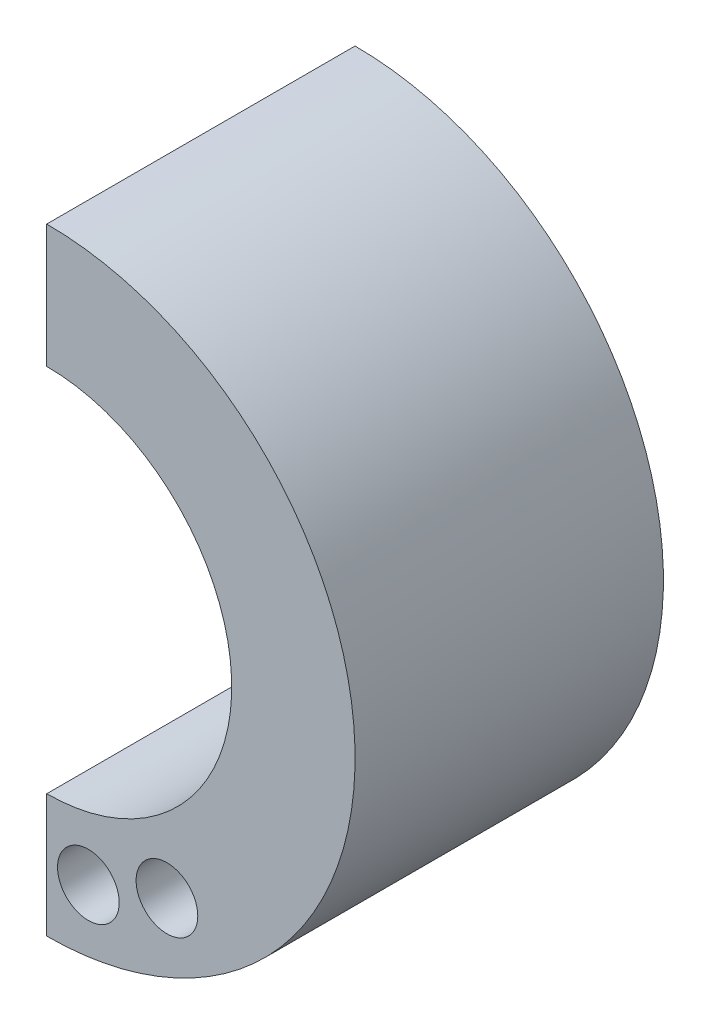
SolidWorks part; units mm, degrees
ref_plane "Ebene vorne" through (0, 0, 0) normal (0, 0, 1) x (1, 0, 0)
ref_plane "Ebene oben" through (0, 0, 0) normal (0, 1, 0) x (1, 0, 0)
ref_plane "Ebene rechts" through (0, 0, 0) normal (1, 0, 0) x (0, 0, -1)
sketch "Skizze1" plane through (0, 0, 0) normal (0, 0, 1) x (1, 0, 0)
  line L0 (0, 50) -> (0, -50)
  arc A0 (0, -50) -> (0, 50) centre (0, 0) ccw
extrude "Linear austragen1" add sketch "Skizze1" along normal blind 50
sketch "Skizze2" plane through (0, 0, 50) normal (0, 0, 1) x (1, 0, 0)
  line L0 (0, 50) -> (0, -50) construction
  arc A0 (0, -40) -> (0, 40) centre (0, 0) ccw
  dimension "D1" = 40
sketch "Skizze4" plane through (0, 0, 50) normal (0, 0, 1) x (1, 0, 0)
  circle A0 centre (6.7528, -39.4259) radius 5
  arc A1 (0, -40) -> (0, 40) centre (0, 0) ccw construction
  dimension "D3" = 10
  dimension "D2" = 6.7528
extrude "Schnitt-Linear austragen1" cut sketch "Skizze4" against normal blind 50
sketch "Skizze5" plane through (0, 0, 50) normal (0, 0, 1) x (1, 0, 0)
  circle A0 centre (19.4926, -34.929) radius 5
  arc A2 (0, -40) -> (0, 40) centre (0, 0) ccw construction
extrude "Schnitt-Linear austragen2" cut sketch "Skizze5" against normal blind 50
sketch "Skizze6" plane through (0, 0, 50) normal (0, 0, 1) x (1, 0, 0)
  line L0 (0, 50) -> (0, -50) construction
  line L1 (0, 30) -> (0, -30)
  arc A0 (0, 30) -> (0, -30) centre (0, 0) cw
extrude "Schnitt-Linear austragen3" cut sketch "Skizze6" against normal blind 50
sketch "Skizze7" plane through (0, 0, 0) normal (0, 0, -1) x (-1, 0, 0)
  line L0 (0, -30) -> (0, -50) construction
  arc A0 (0, 40) -> (0, -40) centre (0, 0) ccw
